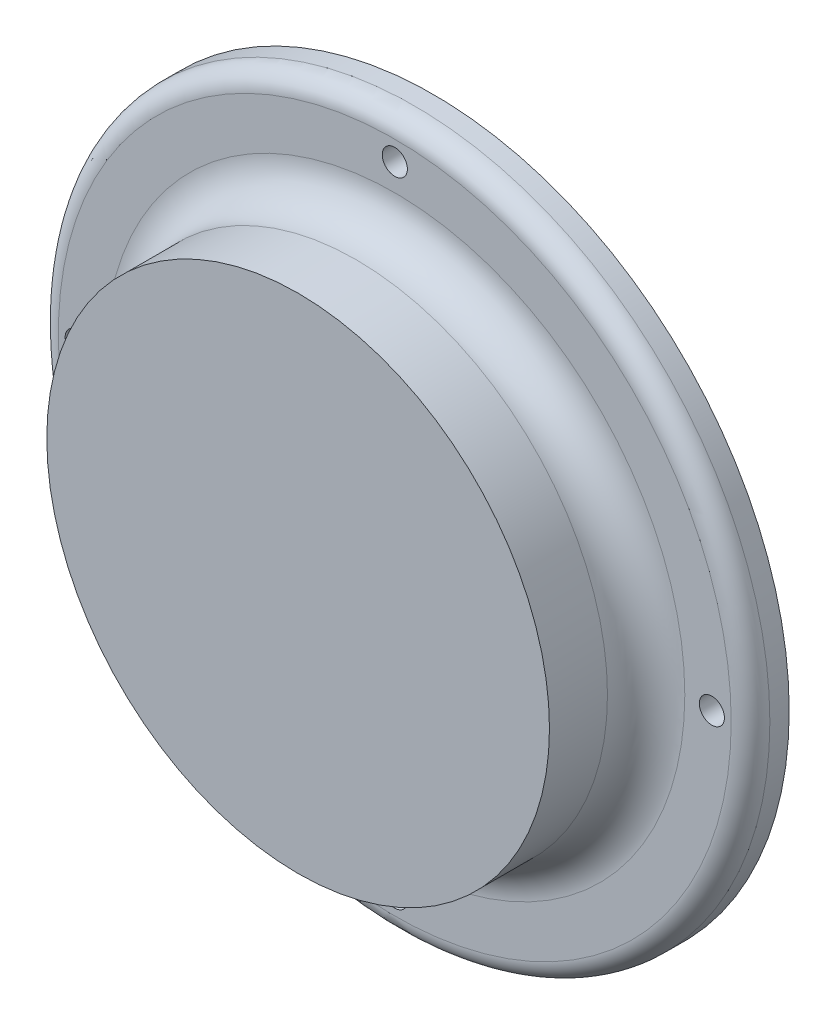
SolidWorks part; units mm, degrees
ref_plane "Face" through (0, 0, 0) normal (0, 0, 1) x (1, 0, 0)
ref_plane "Dessus" through (0, 0, 0) normal (0, 1, 0) x (1, 0, 0)
ref_plane "Droite" through (0, 0, 0) normal (1, 0, 0) x (0, 0, -1)
sketch "Esquisse1" plane through (0, 0, 0) normal (0, 0, 1) x (1, 0, 0)
  circle A1 centre (0, 0) radius 92
  dimension "D1" = 184
extrude "Embase" add sketch "Esquisse1" along normal blind 10
fillet "Arrondi-5mm" radius 5
sketch "Esquisse2" plane through (0, 0, 10) normal (0, 0, 1) x (1, 0, 0)
  circle A0 centre (0, 81.9027) radius 3.25
  circle A1 centre (-82, 0) radius 3.25
  circle A2 centre (0, -82) radius 3.25
  circle A3 centre (82, 0) radius 3.25
  circle A4 centre (0, 0) radius 82 construction
  dimension "D1" = 6.5
  dimension "D2" = 164
extrude "perçages-6,5mm" cut sketch "Esquisse2" against normal through all
sketch "Esquisse3" plane through (0, 0, 10) normal (0, 0, 1) x (1, 0, 0)
  circle A0 centre (0, 0) radius 65
  dimension "D1" = 130
extrude "corps" add sketch "Esquisse3" along normal blind 25
fillet "Congé-10mm" radius 10
sketch "Esquisse4" plane through (0, 0, 0) normal (0, 0, 1) x (1, 0, 0)
  circle A0 centre (0, 0) radius 69
  dimension "D1" = 138
extrude "pénétration cylindrique" add sketch "Esquisse4" against normal blind 7
chamfer "Chanfrein-1.5" distance 1.5 angle 45
